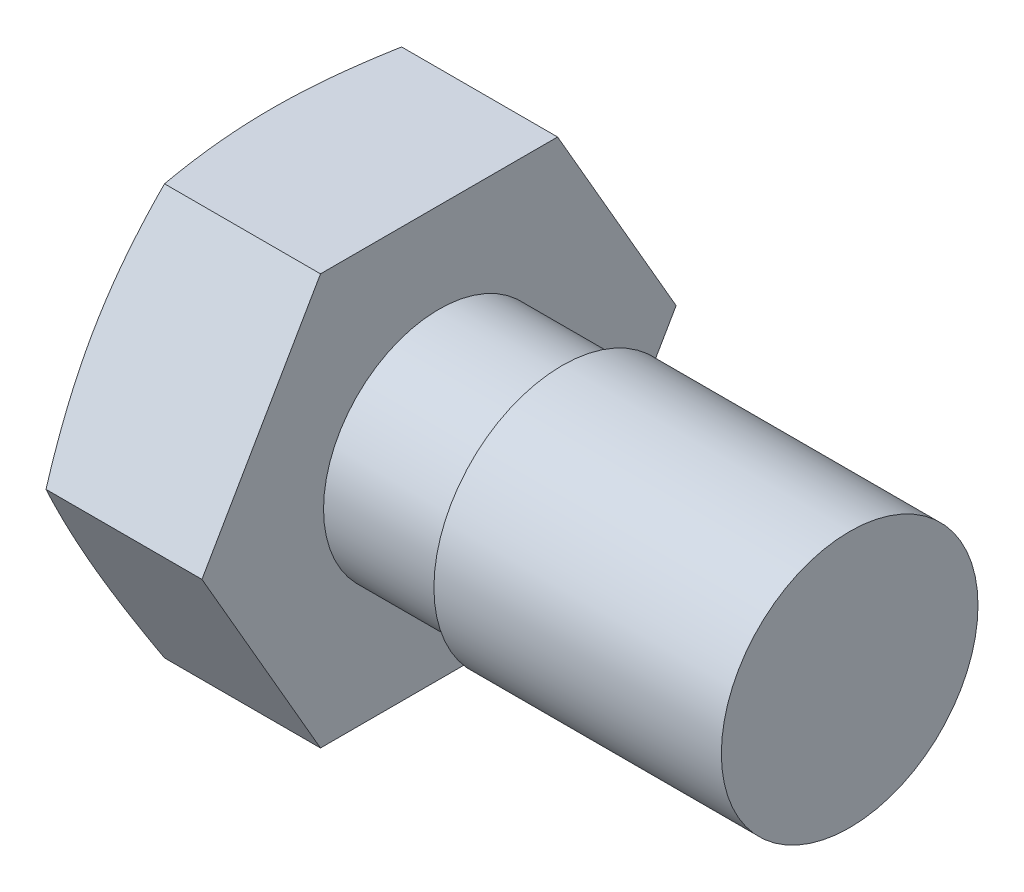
SolidWorks part; units mm, degrees
ref_plane "Front" through (0, 0, 0) normal (0, 0, 1) x (1, 0, 0)
ref_plane "Top" through (0, 0, 0) normal (0, 1, 0) x (1, 0, 0)
ref_plane "Right" through (0, 0, 0) normal (1, 0, 0) x (0, 0, -1)
sketch "Sketch2" plane through (0, 0, 0) normal (1, 0, 0) x (0, 0, -1)
  line L1 (2.3094, -4) -> (4.6188, 0)
  line L2 (4.6188, 0) -> (2.3094, 4)
  line L3 (2.3094, 4) -> (-2.3094, 4)
  line L4 (-2.3094, 4) -> (-4.6188, 0)
  line L5 (-4.6188, 0) -> (-2.3094, -4)
  line L6 (-2.3094, -4) -> (2.3094, -4)
  circle A0 centre (0, 0) radius 4 construction
  dimension "s" = 8
extrude "BaseHead" add sketch "Sketch2" along normal blind 3.5
sketch "Sketch3" plane through (3.5, 0, 0) normal (1, 0, 0) x (0, 0, -1)
  circle A0 centre (0, 0) radius 2.25
  dimension "dn" = 4.5
extrude "Extrude2" add sketch "Sketch3" along normal blind 2.4
sketch "Sketch4" plane through (5.9, 0, 0) normal (1, 0, 0) x (0, 0, -1)
  circle A0 centre (0, 0) radius 2.5
  dimension "d" = 5
extrude "BaseBody" add sketch "Sketch4" along normal offset from surface (5.6 mm away) 8
sketch "Sketch5" plane through (0, 0, 0) normal (0, 1, 0) x (1, 0, 0)
  line L0 (0, 4.6188) -> (0.4618, 4.6188)
  line L1 (0, 4.6188) -> (0, 2.3094) construction
  line L2 (0.4618, 4.6188) -> (0, 3.35)
  line L3 (3.5, 4.6188) -> (0, 4.6188) construction
  line L4 (0, 3.35) -> (0, 4.6188)
  line L5 (-0.3584, 0) -> (3.3946, 0) construction
  dimension "dw" = 6.7
  dimension "D2" = 20
revolve "HeadChamfer" cut sketch "Sketch5" angle 360 about L5
ref_plane "Plane1" through (1.2, 0, 0) normal (1, 0, 0) x (0, 0, -1)
sketch "Sketch6" plane through (0, 0, 0) normal (-1, 0, 0) x (0, 0, 1)
  circle A0 centre (0, 0) radius 3.35
  dimension "D1" = 6.7
extrude "Cut-Extrude1" cut sketch "Sketch6" against normal blind 1.2
sketch "Sketch7" plane through (0, 0, 0) normal (0, 1, 0) x (1, 0, 0)
  line L0 (1.2, 0) -> (6.7401, 0) construction
  line L1 (1.2, 3.35) -> (1.2, -3.35) construction
  line L2 (3.93, 0) -> (0.7, 2.8396)
  line L4 (0.7, 2.8396) -> (0.7, -2.8396)
  line L5 (0.7, -2.8396) -> (3.93, 0)
  line L7 (1.2, 2.4) -> (1.2, -2.4) construction
  dimension "D1" = 0.5
  dimension "h" = 2.73
  dimension "m" = 4.8
extrude "Cut-Extrude2" cut sketch "Sketch7" against normal mid plane 1.092
pattern_circular "CirPattern2" count 2 over 90 about axis through (0, 0, 0) along (1, 0, 0) of "Cut-Extrude2"
equation "\"D1@Sketch6\" = \"dw@Sketch5\""
equation "\"D1@Cut-Extrude1\" = \"k@BaseHead\" - \"k1@Plane1\""
equation "\"dn@Sketch3\" = 0.9 * \"d@Sketch4\""
equation "\"t@Cut-Extrude2\" = 0.4 * \"h@Sketch7\""
